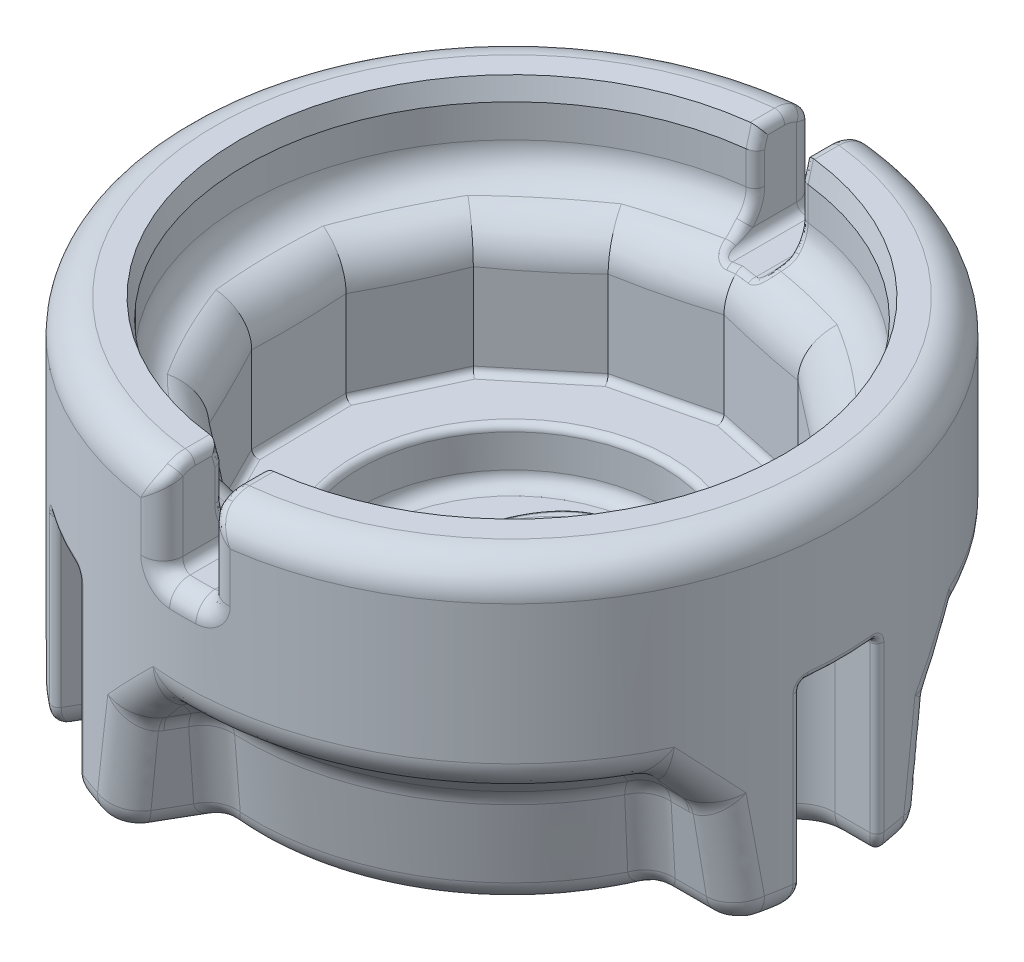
SolidWorks part; units mm, degrees
ref_plane "Front Plane" through (0, 0, 0) normal (0, 0, 1) x (1, 0, 0)
ref_plane "Top Plane" through (0, 0, 0) normal (0, 1, 0) x (1, 0, 0)
ref_plane "Right Plane" through (0, 0, 0) normal (1, 0, 0) x (0, 0, -1)
sketch "Sketch1" plane through (0, 0, 0) normal (0, 1, 0) x (1, 0, 0)
  line L1 (25.8517, -19.9739) -> (31.958, -6.7792)
  line L2 (31.958, -6.7792) -> (31.7345, 7.7582)
  line L3 (31.7345, 7.7582) -> (25.2257, 20.7589)
  line L4 (25.2257, 20.7589) -> (13.7206, 29.6482)
  line L5 (13.7206, 29.6482) -> (-0.502, 32.6652)
  line L6 (-0.502, 32.6652) -> (-14.6252, 29.2125)
  line L7 (-14.6252, 29.2125) -> (-25.8517, 19.9739)
  line L8 (-25.8517, 19.9739) -> (-31.958, 6.7792)
  line L9 (-31.958, 6.7792) -> (-31.7345, -7.7582)
  line L10 (-31.7345, -7.7582) -> (-25.2257, -20.7589)
  line L11 (-25.2257, -20.7589) -> (-13.7206, -29.6482)
  line L12 (-13.7206, -29.6482) -> (0.502, -32.6652)
  line L13 (0.502, -32.6652) -> (14.6252, -29.2125)
  line L14 (14.6252, -29.2125) -> (25.8517, -19.9739)
  circle A0 centre (0, 0) radius 31.85 construction
  circle A1 centre (0, 0) radius 50
extrude "Boss-Extrude1" add sketch "Sketch1" along normal blind 20
sketch "Sketch2" plane through (0, 20, 0) normal (0, 1, 0) x (1, 0, 0)
  circle A0 centre (0, 0) radius 40.5
  circle A1 centre (0, 0) radius 50
extrude "Boss-Extrude2" add sketch "Sketch2" along normal blind 13
fillet "Fillet2" radius 5 1 edges at (0, 20, 40.5)
fillet "Fillet1" radius 6.5 14 edges at (7.5636, 20, 30.9389) (20.2385, 20, 24.5932) (28.9048, 20, 13.3766) (31.8462, 20, -0.4895) (28.4801, 20, -14.2585) (19.4731, 20, -25.2036) (6.6093, 20, -31.1567) (-7.5636, 20, -30.9389) (-20.2385, 20, -24.5932) (-28.9048, 20, -13.3766) (-6.6093, 20, 31.1567) (-19.4731, 20, 25.2036) (-28.4801, 20, 14.2585) (-31.8462, 20, 0.4895)
sketch "Sketch3" plane through (0, 33, 0) normal (0, 1, 0) x (1, 0, 0)
  line L1 (3.375, -55.3651) -> (3.375, 55.274)
  line L2 (-3.375, -55.3651) -> (-3.375, 55.274)
  line L3 (-3.375, -55.3651) -> (3.375, -55.3651)
  line L4 (-3.375, 55.274) -> (3.375, 55.274)
extrude "Cut-Extrude1" cut sketch "Sketch3" against normal blind 14
chamfer "Chamfer1" distance 3 angle 15 2 edges at (40.5, 33, 0) (-40.5, 33, 0)
fillet "Fillet4" radius 1.5 24 edges at (-3.375, 27.5, -40.3591) (-3.375, 27.5, 40.3591) (-3.375, 28.8399, -32.1208) (3.375, 27.5, 40.3591) (3.375, 27.5, -40.3591) (3.375, 28.0827, -31.3824) (3.375, 22.2626, 39.5403) (-3.375, 21.7641, 39.1665) (-3.375, 19, -42.1658) (-3.375, 33, -45.5258) (-3.375, 33, 45.5258) (3.375, 19, -42.1197) (3.375, 33, 45.5258) (3.375, 33, -45.5258) (3.375, 19, 42.1658) (-3.375, 19, 42.1197)
sketch "Sketch4" plane through (0, 0, 0) normal (0, -1, 0) x (1, 0, 0)
  circle A0 centre (0, 0) radius 50
extrude "Boss-Extrude3" add sketch "Sketch4" along normal blind 20
sketch "Sketch5" plane through (0, 0, 0) normal (0, 1, 0) x (1, 0, 0)
  circle A0 centre (0, 0) radius 23
extrude "Cut-Extrude2" cut sketch "Sketch5" against normal blind 8
fillet "Fillet5" radius 1 15 edges at (-6.6093, 0, 31.1567) (-19.4731, 0, 25.2036) (-28.4801, 0, 14.2585) (-31.8462, 0, 0.4895) (-28.9048, 0, -13.3766) (-20.2385, 0, -24.5932) (-7.5636, 0, -30.9389) (6.6093, 0, -31.1567) (19.4731, 0, -25.2036) (28.4801, 0, -14.2585) (31.8462, 0, -0.4895) (28.9048, 0, 13.3766) (20.2385, 0, 24.5932) (7.5636, 0, 30.9389) (0, 0, 23)
fillet "Fillet6" radius 2 1 edges at (0, -8, 23)
fillet "Fillet7" radius 5 2 edges at (50, 33, 0) (-50, 33, 0)
sketch "Sketch7" plane through (0, -20, 0) normal (0, -1, 0) x (1, 0, 0)
  line L9 (-26.6047, -34.5806) -> (-31.6899, -43.3885)
  line L10 (43.25, -5.75) -> (53.4205, -5.75)
  line L11 (43.25, 5.75) -> (53.4921, 5.75)
  line L12 (53.4921, 5.75) -> (53.4205, -5.75)
  line L13 (-21.7664, -49.2005) -> (-31.6899, -43.3885)
  line L14 (-16.6454, -40.3306) -> (-21.7664, -49.2005)
  line L15 (-16.6454, 40.3306) -> (-21.7306, 49.1385)
  line L16 (-31.7257, 43.4505) -> (-21.7306, 49.1385)
  line L17 (-26.6047, 34.5806) -> (-31.7257, 43.4505)
  arc A5 (43.25, 5.75) -> (43.25, -5.75) centre (43.25, 0) ccw
  arc A6 (-16.6454, -40.3306) -> (-26.6047, -34.5806) centre (-21.625, -37.4556) ccw
  arc A7 (-26.6047, 34.5806) -> (-16.6454, 40.3306) centre (-21.625, 37.4556) ccw
  point P3 (-0.1182, -5.7488)
  point P4 (53.4205, -6.0828)
  point P5 (0.1182, 5.7488)
  point P6 (53.4921, 5.417)
  point P19 (0, 0)
  point P23 (0, 0)
  dimension "D1" = 3
extrude "Cut-Extrude3" cut sketch "Sketch7" against normal blind 30
sketch "Sketch10" plane through (0, -20, 0) normal (0, -1, 0) x (-1, 0, 0)
  line L5 (15.7741, -55.3216) -> (5.7298, -37.9244)
  line L6 (40.0229, -41.3216) -> (29.9785, -23.9244)
  line L15 (29.9785, 23.9244) -> (40.0229, 41.3216)
  line L16 (15.7741, 55.3216) -> (5.7298, 37.9244)
  line L17 (-35.7084, 14) -> (-55.797, 14)
  line L18 (-55.797, -14) -> (-35.7084, -14)
  arc A13 (5.7298, 37.9244) -> (-35.7084, 14) centre (0, 0) ccw
  arc A14 (15.7741, 55.3216) -> (-55.797, 14) centre (0, 0) ccw
  arc A15 (40.0229, -41.3216) -> (40.0229, 41.3216) centre (0, 0) ccw
  arc A16 (29.9785, -23.9244) -> (29.9785, 23.9244) centre (0, 0) ccw
  arc A17 (-35.7084, -14) -> (5.7298, -37.9244) centre (0, 0) ccw
  arc A18 (-55.797, -14) -> (15.7741, -55.3216) centre (0, 0) ccw
  point P3 (0, 14)
  point P4 (-61.0068, 14)
  point P5 (0, -14)
  point P6 (-61.0068, -14)
  point P17 (0, 0)
  point P19 (0, 0)
extrude "Cut-Extrude8" cut sketch "Sketch10" against normal blind 22 draft 8
chamfer "Chamfer2" distance 4 angle 50 9 edges at (-6.3846, 2, -45.2422) (20.7233, 2, -35.8939) (42.3731, 2, -17.0919) (42.3731, 2, 17.0919) (-6.3846, 2, 45.2422) (20.7233, 2, 35.8939) (-35.9886, 2, -28.1503) (-35.9886, 2, 28.1503) (-41.4467, 2, 0)
fillet "Fillet34" radius 5 5 edges at (-36.9436, -11.832, 33.6923) (-36.9436, -11.832, -33.6923) (-39.3901, -0.8331, 30.7964) (-39.3901, -0.8331, -30.7964) (-50, 2, 0)
fillet "Fillet38" radius 5 5 edges at (47.6502, -11.832, 15.1479) (-10.7066, -11.832, 48.8402) (-6.9754, -0.8331, 49.511) (46.3655, -0.8331, 18.7147) (25, 2, 43.3013)
fillet "Fillet44" radius 5 5 edges at (47.6502, -11.832, -15.1479) (-10.7066, -11.832, -48.8402) (46.3655, -0.8331, -18.7147) (-6.9754, -0.8331, -49.511) (25, 2, -43.3013)
fillet "Fillet16" radius 4 24 edges at (-28.2092, -20, -37.3598) (-18.2499, -20, -43.1098) (-18.2499, -20, 43.1098) (-28.2092, -20, 37.3598) (46.4591, -20, -5.75) (46.4591, -20, 5.75) (37.5, -20, 0) (-18.75, -20, -32.476) (-18.75, -20, 32.476) (-32.0717, -20, -27.5497) (-38.3548, -20, 0) (-32.0717, -20, 27.5497) (39.8946, -20, -14) (19.1774, -20, -33.2162) (-7.823, -20, -41.5497) (-7.823, -20, 41.5497) (19.1774, -20, 33.2162) (39.8946, -20, 14) (-34.7746, -20, -34.4158) (-34.7574, -20, 34.5219) (-12.4177, -20, 47.3236) (47.2756, -20, 12.8398) (-12.5182, -20, -47.3618) (47.1923, -20, -12.9078)
fillet "Fillet8" radius 1 30 edges at (-29.8138, -3, -40.139) (-19.8545, -3, -45.889) (-19.8545, -3, 45.889) (-29.8138, -3, 40.139) (49.6683, -3, -5.75) (49.6683, -3, 5.75) (-28.2092, 10, -37.3598) (-18.75, 10, -32.476) (-18.2499, 10, -43.1098) (-25, 10, -43.3013) (-18.2499, 10, 43.1098) (-18.75, 10, 32.476) (-28.2092, 10, 37.3598) (-25, 10, 43.3013) (46.4591, 10, -5.75) (37.5, 10, 0) (46.4591, 10, 5.75) (50, 10, 0) (-29.956, -17.8839, -39.4426) (-29.956, -17.8839, 39.4426) (-19.1802, -17.8839, 45.664) (49.1363, -17.8839, 6.2214) (-19.1802, -17.8839, -45.664) (49.1363, -17.8839, -6.2214)
sketch "Sketch8" plane through (0, -20, 0) normal (0, -1, 0) x (1, 0, 0)
  line L1 (14.607, 0) -> (7.3035, 12.65)
  line L2 (7.3035, 12.65) -> (-7.3035, 12.65)
  line L3 (-7.3035, 12.65) -> (-14.607, 0)
  line L4 (-14.607, 0) -> (-7.3035, -12.65)
  line L5 (-7.3035, -12.65) -> (7.3035, -12.65)
  line L6 (7.3035, -12.65) -> (14.607, 0)
  circle A0 centre (0, 0) radius 12.65 construction
extrude "Boss-Extrude4" add sketch "Sketch8" along normal blind 16
fillet "Fillet9" radius 3 6 edges at (-10.9552, -20, 6.325) (0, -20, 12.65) (10.9552, -20, 6.325) (10.9552, -20, -6.325) (0, -20, -12.65) (-10.9552, -20, -6.325)
fillet "Fillet10" radius 1 6 edges at (0, -36, -12.65) (-10.9552, -36, -6.325) (-10.9552, -36, 6.325) (0, -36, 12.65) (10.9552, -36, 6.325) (10.9552, -36, -6.325)
fillet "Fillet11" radius 0.95 18 edges at (14.2688, -35.7071, 0) (15.6216, -20.8787, 0) (7.1344, -35.7071, -12.3571) (7.8108, -20.8787, -13.5287) (-7.1344, -35.7071, -12.3571) (-7.3035, -29, -12.65) (-14.2688, -35.7071, 0) (-15.6216, -20.8787, 0) (7.1344, -35.7071, 12.3571) (7.8108, -20.8787, 13.5287) (-7.1344, -35.7071, 12.3571) (-7.8108, -20.8787, 13.5287) (14.607, -29, 0) (7.3035, -29, -12.65) (-7.8108, -20.8787, -13.5287) (-14.607, -29, 0) (7.3035, -29, 12.65) (-7.3035, -29, 12.65)
fillet "Fillet17" radius 3 14 edges at (3.511, 32.1242, -47.6978) (3.375, 24.25, -49.886) (2.8126, 19.3292, -49.9208) (-3.511, 32.1242, -47.6978) (-3.375, 24.25, -49.886) (-3.0474, 19.5644, -49.907) (-3.511, 32.1242, 47.6978) (-3.375, 24.25, 49.886) (-2.8126, 19.3292, 49.9208) (3.511, 32.1242, 47.6978) (3.375, 24.25, 49.886) (3.0474, 19.5644, 49.907) (0, 19, -50) (0, 19, 50)
fillet "Fillet35" radius 5 18 edges at (-29.3765, -18.6693, 23.8778) (-29.3765, -18.6693, -23.8778) (-34.2244, -3.7261, 26.704) (-34.2244, -3.7261, -26.704) (-40.6419, -3.7261, 0) (-36.5804, -2.9234, 32.6819) (-40.782, 4.207, 27.4516) (-40.782, 4.207, -27.4516) (-36.5804, -2.9234, -32.6819) (-45.4467, 2, 0)
fillet "Fillet39" radius 5 18 edges at (-5.9905, -18.6693, 37.3797) (35.367, -18.6693, 13.5019) (40.2386, -3.7261, 16.2872) (20.321, -3.7261, 35.1969) (-6.0142, -3.7261, 42.9912) (46.5936, -2.9234, 15.3386) (-10.0131, -2.9234, 48.0205) (-3.3828, 4.207, 49.0441) (44.1648, 4.207, 21.5925) (22.7233, 2, 39.358)
fillet "Fillet45" radius 5 18 edges at (35.367, -18.6693, -13.5019) (-5.9905, -18.6693, -37.3797) (40.2386, -3.7261, -16.2872) (20.321, -3.7261, -35.1969) (-6.0142, -3.7261, -42.9912) (46.5936, -2.9234, -15.3386) (-10.0131, -2.9234, -48.0205) (44.1648, 4.207, -21.5925) (-3.3828, 4.207, -49.0441) (22.7233, 2, -39.358)
sketch "Sketch12" plane through (0, -8, 0) normal (0, 1, 0) x (1, 0, 0)
  line L0 (2.7371, 2.5751) -> (2.7049, -2.0694)
  line L1 (5.9294, 9.3242) -> (5.6635, 9.2303) construction
  line L2 (7.392, -2.7711) -> (6.0559, -3.207) construction
  line L3 (6.0559, -3.207) -> (2.9486, -3.7982) construction
  line L4 (9.5697, -4.351) -> (9.9931, -1.1851) construction
  line L5 (8.2677, -7.768) -> (8.9093, -6.5036) construction
  line L6 (0, 0) -> (0.1457, 2.7746) construction
  line L7 (0.1219, -2.2559) -> (0, 0) construction
  line L8 (-5.8061, 3.8049) -> (-5.5965, 3.8557) construction
  line L9 (-0.3597, -3.9775) -> (-2.0756, -3.9032) construction
  line L10 (1.6393, 8.4655) -> (1.9038, 9.0519) construction
  line L11 (-4.6453, 12.4702) -> (-4.9996, 12.1705) construction
  line L12 (-0.0208, 14.2354) -> (-0.3944, 14.22) construction
  line L13 (-6.1709, 14.4187) -> (-5.7891, 14.7633) construction
  line L14 (-9.0285, 10.602) -> (-8.7194, 11.156) construction
  spline S0 degree 3 poles (2.7371, 2.5751) (3.724, 2.4219) (4.9827, 2.1624) (6.3339, 1.4074) (6.839, 0.9707) (7.0438, 0.49) (7.0751, 0.2192) (7.029, -0.048) (6.8088, -0.5237) (6.2705, -0.9461) (4.9063, -1.6663) (3.677, -1.9143) (2.7049, -2.0694) knots 0 0 0 0 0.293358 0.354682 0.446763 0.477092 0.503034 0.523959 0.55437 0.651716 0.711875 1 1 1 1
  spline S1 degree 3 poles (9.9885, 1.6891) (9.5213, 2.1881) (8.6412, 2.767) (6.3171, 3.7603) (4.4814, 4.12) (3.012, 4.3012) knots 0 0 0 0 0.26941 0.411395 1 1 1 1
  spline S2 degree 3 poles (9.9885, 1.6891) (9.8309, 2.9684) (9.6225, 4.6256) (8.9714, 6.6096) (8.4894, 7.6732) (7.8454, 8.6257) (7.1281, 9.2053) (6.4046, 9.4154) (5.8062, 9.3155) (5.1017, 8.9408) (3.8175, 7.3947) (3.3011, 5.6486) (3.012, 4.3012) knots 0 0 0 0 0.251045 0.320553 0.404301 0.47667 0.542004 0.578292 0.619394 0.655991 0.731079 1 1 1 1
  spline S3 degree 3 poles (9.9931, -1.1851) (9.2392, -1.8941) (8.0982, -2.5604) (5.6751, -3.3322) (4.1654, -3.5799) (2.9486, -3.7982) knots 0 0 0 0 0.400836 0.512166 1 1 1 1
  spline S4 degree 3 poles (9.9931, -1.1851) (9.8215, -2.5378) (9.6894, -4.3828) (8.9304, -6.5176) (8.3416, -7.7245) (7.5942, -8.6819) (6.7338, -9.181) (5.9774, -9.1801) (5.3236, -8.879) (4.6087, -8.2175) (3.6273, -6.5521) (3.1556, -4.9623) (2.9486, -3.7982) knots 0 0 0 0 0.256945 0.338811 0.42156 0.506873 0.562113 0.599919 0.643323 0.693235 0.779501 1 1 1 1
  spline S5 degree 3 poles (0.1457, 2.7746) (0.1536, 1.8497) (-0.1392, 0.1727) (0.1249, -1.5039) (0.1219, -2.2559) knots 0 0 0 0 0.551533 1 1 1 1
  spline S6 degree 3 poles (0.1457, 2.7746) (-0.8589, 2.7601) (-2.576, 2.6478) (-4.7871, 2.1774) (-6.1057, 1.5536) (-6.7131, 0.954) (-6.9283, 0.5691) (-6.9852, 0.0926) (-6.8266, -0.3084) (-6.2626, -0.9358) (-5.3968, -1.3971) (-3.1636, -2.1139) (-1.3431, -2.2591) (0.1219, -2.2559) knots 0 0 0 0 0.189004 0.322302 0.42435 0.456932 0.481413 0.505748 0.545002 0.557473 0.66428 0.722238 1 1 1 1
  spline S7 degree 3 poles (0.3954, 4.4767) (-1.6476, 4.5146) (-4.4718, 4.2713) (-7.9832, 3.1475) (-9.4084, 2.3276) (-10.0152, 1.6744) knots 0 0 0 0 0.557404 0.761581 1 1 1 1
  spline S8 degree 3 poles (-10.017, -1.1887) (-9.5043, -1.6906) (-8.1385, -2.5872) (-6.269, -3.1937) (-4.6697, -3.5595) (-2.6541, -3.9097) (-0.9304, -3.9687) (0.3755, -3.975) knots 0 0 0 0 0.194688 0.442025 0.531293 0.642901 1 1 1 1
  spline S9 degree 3 poles (4.3819, -12.2886) (3.864, -11.742) (1.9239, -9.294) (0.8252, -6.2885) (0.3755, -3.975) knots 0 0 0 0 0.241909 1 1 1 1
  spline S10 degree 3 poles (0.3954, 4.4767) (1.0344, 7.5103) (2.2629, 10.4574) (4.3805, 12.7928) knots 0 0 0 0 1 1 1 1
  spline S11 degree 3 poles (-10.017, -1.1887) (-9.7201, -3.2899) (-8.8402, -6.7267) (-6.5398, -10.4292) (-4.4009, -12.3895) (-2.3808, -13.4822) (-0.3254, -13.8766) (2.059, -13.5972) (3.5265, -12.8595) (4.3819, -12.2886) knots 0 0 0 0 0.288203 0.474461 0.58186 0.678213 0.782328 0.859928 1 1 1 1
  spline S12 degree 3 poles (-10.0152, 1.6744) (-9.5973, 4.2784) (-8.4632, 8.2333) (-5.2516, 12.232) (-2.5703, 13.8613) (0.7268, 14.5276) (3.0693, 13.7295) (4.3805, 12.7928) knots 0 0 0 0 0.359809 0.548515 0.685701 0.77859 1 1 1 1
  spline S13 degree 3 poles (-10.7567, 6.7606) (-11.5043, 2.6407) (-11.5323, -1.4584) (-10.9662, -5.6638) (-9.3527, -10.1573) (-6.7167, -13.8245) (-3.7881, -15.9738) (-1.0204, -16.8437) (1.5357, -16.7231) (3.8282, -15.9578) (7.8307, -13.2732) (10.767, -7.6793) (11.8484, -0.8229) (11.4332, 4.8198) (9.7484, 10.0261) (6.8513, 14.3964) (2.5742, 17.2081) (-2.3178, 17.1631) (-6.2817, 14.7071) (-8.9398, 11.1335) (-10.7567, 6.7606) (-11.5043, 2.6407) (-11.5323, -1.4584) knots -0.157229 -0.104827 -0.058962 0 0.03365 0.077678 0.141129 0.191133 0.226091 0.260821 0.285669 0.310373 0.340653 0.44471 0.507501 0.572246 0.631514 0.688521 0.744707 0.794671 0.842771 0.895173 0.941038 1 1.03365 1.077678 1.141129 only from (-11.446, 1.8783) to (-11.446, 1.8783)
extrude "Boss-Extrude6" add sketch "Sketch12" along normal blind 3 draft 5
fillet "Fillet63" radius 0.6 2 edges at (1.6092, -5, -7.6931) (-2.8301, -5, -13.8741)
fillet "Fillet64" radius 0.6 1 edges at (-11.1938, -5, 1.3484)
fillet "Fillet65" radius 0.6 2 edges at (-3.6572, -5, -3.9711)
fillet "Fillet66" radius 0.6 2 edges at (-3.7719, -5, 12.9975) (6.6056, -5, -3.2854)
fillet "Fillet67" radius 0.6 2 edges at (7.0517, -5, -9.4743) (-6.0959, -5, 2.9387)
fillet "Fillet68" radius 0.6 4 edges at (1.9936, -5, 8.2309) (7.2964, -5, 2.5265) (-7.163, -5, -0.6112) (0.2953, -5, 0.7105)
fillet "Fillet69" radius 0.6 3 edges at (6.2351, -5, 9.4306) (2.4585, -5, -0.2519) (7.3248, -5, -0.1877)
fillet "Fillet77" radius 0.9 14 edges at (-6.2992, -8, 3.1536) (2.9289, -8, 10.4566) (-2.8378, -8, 13.1781) (-6.928, -8, -0.4727) (0.0153, -8, 0.4485) (-5.0869, -8, -3.976) (1.4016, -8, -7.8838) (-2.8699, -8, -13.5683) (2.721, -8, -0.2529) (7.0633, -8, -0.2594) (7.9405, -8, 2.545) (6.2406, -8, 9.168) (6.5713, -8, -3.5716) (6.4671, -8, -9.3647)
